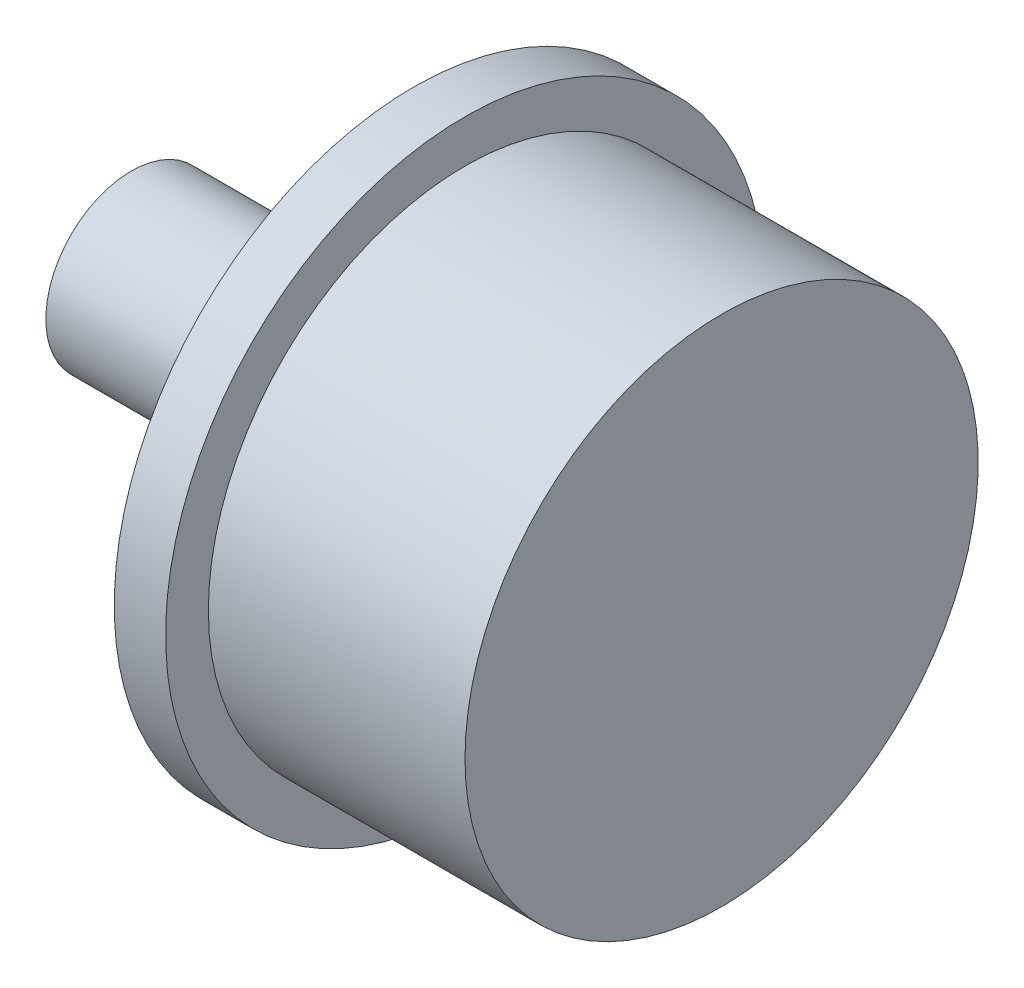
SolidWorks part; units mm, degrees
ref_plane "Front Plane" through (0, 0, 0) normal (0, 0, 1) x (1, 0, 0)
ref_plane "Top Plane" through (0, 0, 0) normal (0, 1, 0) x (1, 0, 0)
ref_plane "Right Plane" through (0, 0, 0) normal (1, 0, 0) x (0, 0, -1)
sketch "Sketch1" plane through (0, 0, 0) normal (1, 0, 0) x (0, 0, -1)
  circle A0 centre (0, 0) radius 22.225
  dimension "D1" = 44.45
extrude "Extrude1" add sketch "Sketch1" against normal blind 3.81
sketch "Sketch2" plane through (0, 0, 0) normal (1, 0, 0) x (0, 0, -1)
  circle A0 centre (0, 0) radius 19.05
  dimension "D1" = 38.1
extrude "Extrude2" add sketch "Sketch2" along normal blind 19.05
sketch "Sketch3" plane through (-3.81, 0, 0) normal (-1, 0, 0) x (0, 0, 1)
  circle A0 centre (0, 0) radius 7.62
  dimension "D1" = 15.24
extrude "Extrude3" add sketch "Sketch3" along normal blind 1.905
sketch "Sketch4" plane through (-5.715, 0, 0) normal (-1, 0, 0) x (0, 0, 1)
  circle A0 centre (0, 0) radius 6.35
  dimension "D1" = 12.7
extrude "Extrude4" add sketch "Sketch4" along normal blind 19.05
